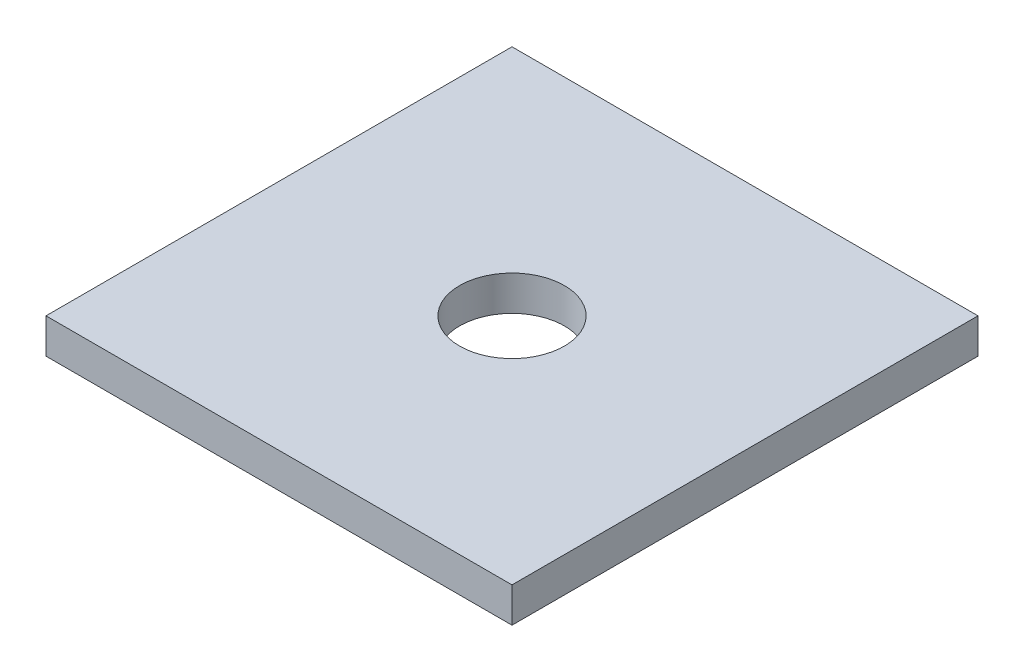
SolidWorks part; units mm, degrees
ref_plane "Front Plane" through (0, 0, 0) normal (0, 0, 1) x (1, 0, 0)
ref_plane "Top Plane" through (0, 0, 0) normal (0, 1, 0) x (1, 0, 0)
ref_plane "Right Plane" through (0, 0, 0) normal (1, 0, 0) x (0, 0, -1)
sketch "Sketch1" plane through (0, 0, 0) normal (0, 1, 0) x (1, 0, 0)
  line L0 (40, 40) -> (0, 0) construction
  line L1 (0, 0) -> (40, 0)
  line L2 (0, 0) -> (0, 40)
  line L3 (0, 40) -> (40, 40)
  line L4 (40, 0) -> (40, 40)
  circle A0 centre (20, 20) radius 4.5
  dimension "D2" = 9
  dimension "D1" = 40
extrude "Extrude1" add sketch "Sketch1" along normal blind 3
